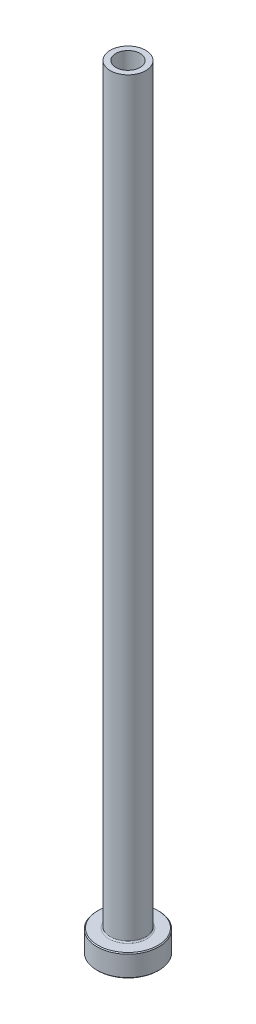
SolidWorks part; units mm, degrees
ref_plane "Front Plane" through (0, 0, 0) normal (0, 0, 1) x (1, 0, 0)
ref_plane "Top Plane" through (0, 0, 0) normal (0, 1, 0) x (1, 0, 0)
ref_plane "Right Plane" through (0, 0, 0) normal (1, 0, 0) x (0, 0, -1)
sketch "Sketch1" plane through (0, 0, 0) normal (0, 0, 1) x (1, 0, 0)
  line L0 (-2.75, 175) -> (-4, 175)
  line L1 (-4, 175) -> (-4, 5)
  line L2 (-4, 5) -> (-7, 5)
  line L3 (-7, 5) -> (-7, 0)
  line L4 (7.7, 0) -> (-7.7, 0) construction
  line L5 (-7, 0) -> (-3, 0)
  line L6 (-2.75, 130) -> (-2.75, 175)
  line L7 (0, 92.1877) -> (0, -15.5353) construction
  line L8 (0, -7.7) -> (0, 7.7) construction
  line L9 (-2.75, 130) -> (-3, 118)
  line L10 (-3, 118) -> (-3, 0)
  dimension "D1" = 0.25
  dimension "ID" = 5.5
  dimension "OD" = 8
  dimension "L" = 175
  dimension "H" = 14
  dimension "T" = 5
  dimension "N" = 45
  dimension "D2" = 12
revolve "Revolve1" add sketch "Sketch1" angle 360 about L7
fillet "Fillet1" radius 0.3 1 edges at (0, 5, 4)
chamfer "Chamfer1" distance 0.2 angle 45 2 edges at (0, 5, 7) (0, 0, 7)
chamfer "Chamfer3" distance 0.5 angle 45 1 edges at (0, 0, 3)
